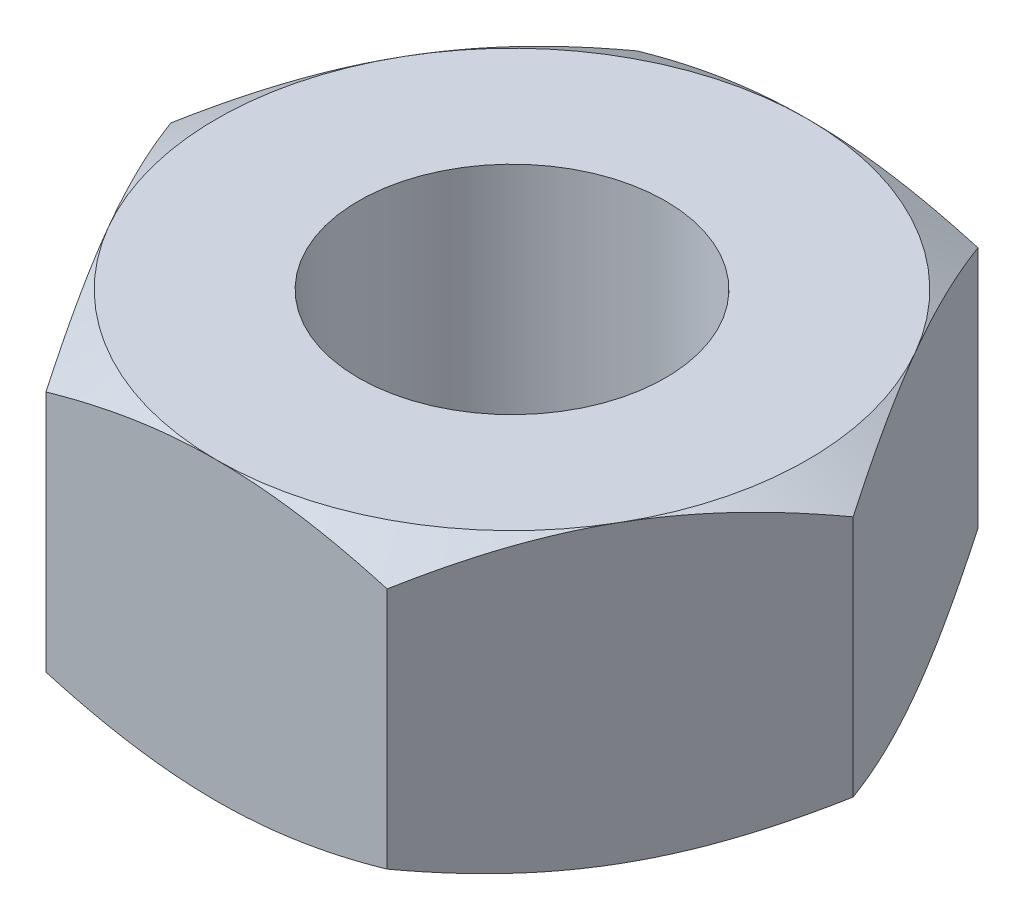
SolidWorks part; units mm, degrees
ref_plane "Plan de face" through (0, 0, 0) normal (0, 0, 1) x (1, 0, 0)
ref_plane "Plan de dessus" through (0, 0, 0) normal (0, 1, 0) x (1, 0, 0)
ref_plane "Plan de droite" through (0, 0, 0) normal (1, 0, 0) x (0, 0, -1)
sketch "Esquisse1" plane through (0, 0, 0) normal (0, 1, 0) x (1, 0, 0)
  line L1 (7.5056, 0) -> (3.7528, 6.5)
  line L2 (3.7528, 6.5) -> (-3.7528, 6.5)
  line L3 (-3.7528, 6.5) -> (-7.5056, 0)
  line L4 (-7.5056, 0) -> (-3.7528, -6.5)
  line L5 (-3.7528, -6.5) -> (3.7528, -6.5)
  line L6 (3.7528, -6.5) -> (7.5056, 0)
  circle A0 centre (0, 0) radius 6.5 construction
  dimension "D1" = 13
extrude "Extrusion1" add sketch "Esquisse1" along normal mid plane 6.5
sketch "Esquisse2" plane through (0, 0, 0) normal (1, 0, 0) x (0, 0, -1)
  line L0 (3.5, 4.9821) -> (9.5, 4.9821)
  line L1 (9.5, 4.9821) -> (9.5, 1.5179)
  line L2 (9.5, 1.5179) -> (3.5, 4.9821)
  line L3 (0, 9.378) -> (0, -1.3286) construction
  dimension "D1" = 30
  dimension "D2" = 3
revolve "Enlèvement de matière-Révolution4" cut sketch "Esquisse2" angle 360 about L3
mirror "Symétrie1" about plane through (0, 0, 0) normal (0, 1, 0) of "Enlèvement de matière-Révolution4"
sketch "Esquisse3" plane through (0, 3.25, 0) normal (0, 1, 0) x (-1, 0, 0)
  circle A0 centre (0, 0) radius 3.375
  dimension "D1" = 6.75
extrude "Enlèv. mat.-Extru.1" cut sketch "Esquisse3" against normal through all
